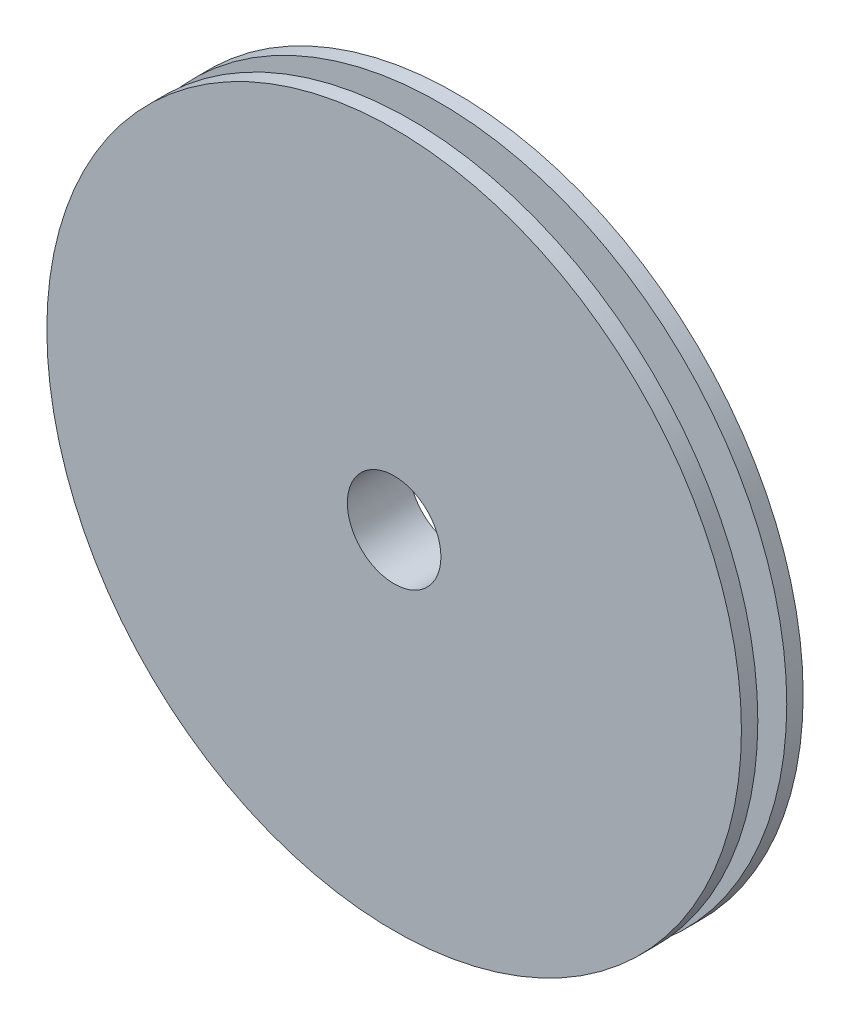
SolidWorks part; units mm, degrees
ref_plane "Front Plane" through (0, 0, 0) normal (0, 0, 1) x (1, 0, 0)
ref_plane "Top Plane" through (0, 0, 0) normal (0, 1, 0) x (1, 0, 0)
ref_plane "Right Plane" through (0, 0, 0) normal (1, 0, 0) x (0, 0, -1)
sketch "Sketch1" plane through (0, 0, 0) normal (0, 0, 1) x (1, 0, 0)
  circle A0 centre (0, 0) radius 18
  dimension "D1" = 36
extrude "Boss-Extrude1" add sketch "Sketch1" along normal blind 3.2
sketch "Sketch2" plane through (0, 0, 3.2) normal (0, 0, 1) x (1, 0, 0)
  circle A0 centre (0, 0) radius 2.425
  dimension "D1" = 4.85
extrude "Cut-Extrude1" cut sketch "Sketch2" against normal blind 43 and the other way blind 17
ref_plane "Plane1" through (0, 0, 1.6) normal (0, 0, 1) x (1, 0, 0)
sketch "Sketch5" plane through (0, 0, 1.6) normal (0, 0, 1) x (1, 0, 0)
  circle A0 centre (0, 0) radius 18
  circle A1 centre (0, 0) radius 15.5
  dimension "D1" = 2.5
  dimension "D2" = 36
extrude "Cut-Extrude4" cut sketch "Sketch5" against normal mid plane 1.5 contours A0 | A1
